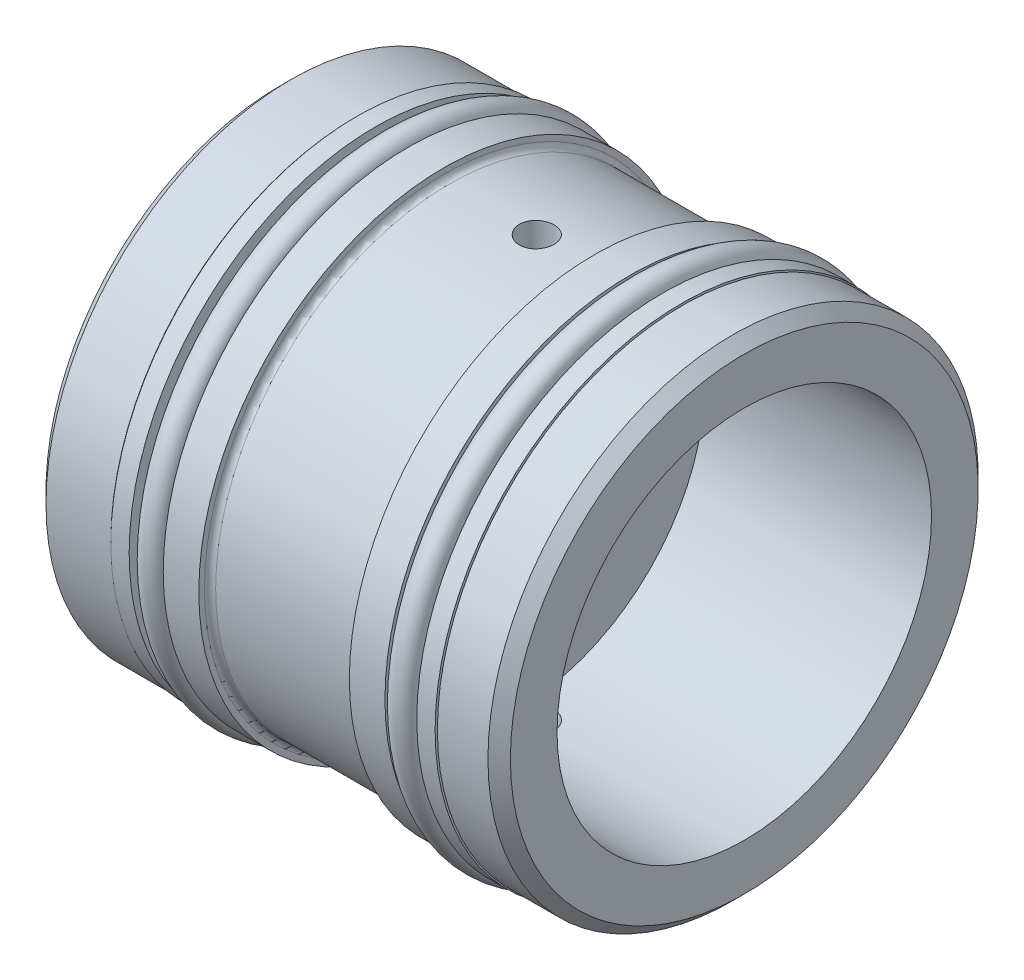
SolidWorks part; units mm, degrees
ref_plane "Front Plane" through (0, 0, 0) normal (0, 0, 1) x (1, 0, 0)
ref_plane "Top Plane" through (0, 0, 0) normal (0, 1, 0) x (1, 0, 0)
ref_plane "Right Plane" through (0, 0, 0) normal (1, 0, 0) x (0, 0, -1)
sketch "Sketch1" plane through (0, 0, 0) normal (0, 0, 1) x (1, 0, 0)
  line L0 (0, 0) -> (0, 45.5562) construction
  line L1 (0, 0) -> (32.8567, 0) construction
  line L2 (-15.748, 6.35) -> (-15.748, 16.6243)
  line L3 (-15.748, 16.6243) -> (-10.5918, 16.6243)
  line L4 (-10.5918, 16.6243) -> (-10.5918, 15.3543)
  line L5 (-10.5918, 15.3543) -> (-7.0358, 15.3543)
  line L6 (-7.0358, 15.3543) -> (-7.0358, 16.6243)
  line L7 (-7.0358, 16.6243) -> (-4.6228, 16.6243)
  line L8 (-4.6228, 16.6243) -> (-4.6228, 15.8623)
  line L9 (-4.6228, 15.8623) -> (5.588, 15.8623)
  line L10 (-15.748, 6.35) -> (0.3556, 6.35)
  line L11 (0.3556, 6.35) -> (0.3556, 12.7)
  line L12 (0.3556, 12.7) -> (15.748, 12.7)
  line L13 (5.588, 16.6243) -> (5.588, 15.8623)
  line L14 (8.001, 16.6243) -> (5.588, 16.6243)
  line L15 (8.001, 15.3543) -> (8.001, 16.6243)
  line L16 (11.557, 15.3543) -> (8.001, 15.3543)
  line L17 (11.557, 16.6243) -> (11.557, 15.3543)
  line L18 (15.748, 16.6243) -> (11.557, 16.6243)
  line L19 (15.748, 16.6243) -> (15.748, 12.7)
  dimension "D2" = 3.556
  dimension "D3" = 10.2108
  dimension "D4" = 33.2486
  dimension "D5" = 31.496
  dimension "D6" = 25.4
  dimension "D7" = 15.3924
  dimension "D8" = 31.7246
  dimension "D9" = 30.7086
  dimension "D10" = 12.7
  dimension "D11" = 26.3398
  dimension "D12" = 2.413
  dimension "D13" = 2.413
revolve "Revolve1" add sketch "Sketch1" angle 360 about L1
fillet "Fillet1" radius 0.381 2 edges at (5.588, 0, 15.8623) (-4.6228, 0, 15.8623)
chamfer "Chamfer1" distance 0.762 angle 45 2 edges at (15.748, 0, 16.6243) (-15.748, 0, 16.6243)
sketch "Sketch6" plane through (0, 0, 0) normal (0, 0, 1) x (1, 0, 0)
  line L0 (0, 0) -> (49.5791, 0) construction
  line L1 (-15.748, 15.8623) -> (-15.748, -15.8623) construction
  line L2 (-7.0358, 15.3543) -> (-10.5918, 15.3543) construction
  line L3 (-10.5156, 15.3543) -> (-9.271, 15.3543)
  line L4 (-10.5156, 15.3543) -> (-10.5156, 16.7005)
  line L5 (-10.5156, 16.7005) -> (-9.271, 16.7005)
  line L6 (-9.271, 15.3543) -> (-9.271, 16.7005)
  line L7 (0.4826, 41.4439) -> (0.4826, -9.3524) construction
  line L8 (-10.5918, -16.6243) -> (-10.5918, 16.6243) construction
  line L9 (11.557, 15.3543) -> (11.557, -15.3543) construction
  line L10 (-7.0358, 16.6243) -> (-7.0358, -16.6243) construction
  line L11 (10.2362, 15.3543) -> (10.2362, 16.7005)
  line L12 (11.4808, 16.7005) -> (10.2362, 16.7005)
  line L13 (11.4808, 15.3543) -> (11.4808, 16.7005)
  line L14 (11.4808, 15.3543) -> (10.2362, 15.3543)
  circle A0 centre (-8.001, 16.1671) radius 0.889
  circle A1 centre (8.9662, 16.1671) radius 0.889
  dimension "D4" = 1.778
  dimension "D5" = 32.3342
  dimension "D6" = 0.9652
  dimension "D1" = 1.2446
  dimension "D2" = 5.2324
  dimension "D3" = 33.401
revolve "Revolve3" add sketch "Sketch6" angle 360 about L0
sketch "Sketch7" plane through (0, 0, 0) normal (0, 1, 0) x (0, 0, -1)
  line L1 (-15.8623, -15.748) -> (15.8623, -15.748) construction
  circle A0 centre (0, -1.6764) radius 1.1811
  dimension "D1" = 2.3622
  dimension "D2" = 14.0716
extrude "Cut-Extrude1" cut sketch "Sketch7" against normal through all and the other way through all
